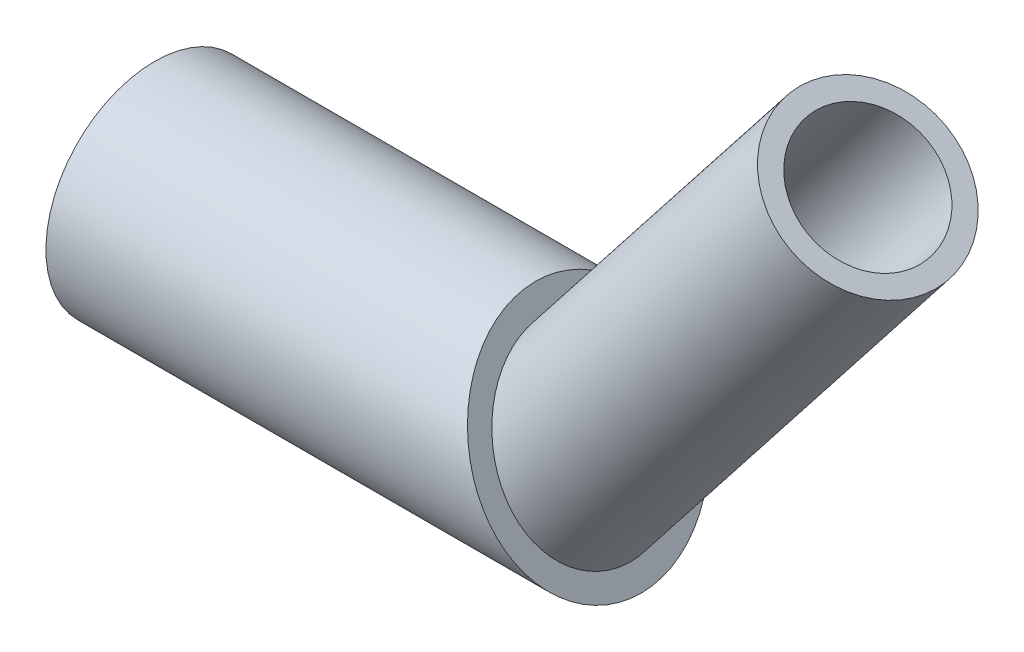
SolidWorks part; units mm, degrees
ref_plane "Ebene vorne" through (0, 0, 0) normal (0, 0, 1) x (1, 0, 0)
ref_plane "Ebene oben" through (0, 0, 0) normal (0, 1, 0) x (1, 0, 0)
ref_plane "Ebene rechts" through (0, 0, 0) normal (1, 0, 0) x (0, 0, -1)
sketch "Skizze1" plane through (0, 0, 0) normal (0, 0, 1) x (1, 0, 0)
  line L0 (0, 0) -> (67.2648, 0)
  line L1 (67.2648, 0) -> (110.6167, 55.2329)
other "Strukturbauteil1"
ref_plane "Ebene1" through (0, 0, 0) normal (1, 0, 0) x (0, 0, 1)
sketch "Sketch1" plane through (0, 0, 0) normal (1, 0, 0) x (0, 0, 1)
  circle A0 centre (0, 0) radius 12.85
  circle A1 centre (0, 0) radius 16.85
  point P3 (0, 0)
  dimension "In_dia" = 25.7
  dimension "Out_dia" = 33.7
other "Strukturbauteil2"
ref_plane "Ebene3" through (67.2648, 0, 0) normal (0.6174, 0.7866, 0) x (0, 0, 1)
sketch "Sketch12" plane through (67.2648, 0, 0) normal (0.6174, 0.7866, 0) x (0, 0, 1)
  circle A0 centre (0, 0) radius 10.25
  circle A1 centre (0, 0) radius 13.45
  point P3 (0, 0)
  dimension "In_dia" = 20.5
  dimension "Out_dia" = 26.9
other "Trimmen/Verlängern1"
equation "\"LÄNGE\"=0"
equation "\"BREITE\"=0"
equation "\"HÖHE\"=0"
equation "\"DURCHMESSER\"=0"
equation "\"Stückzahl\"= 1"
